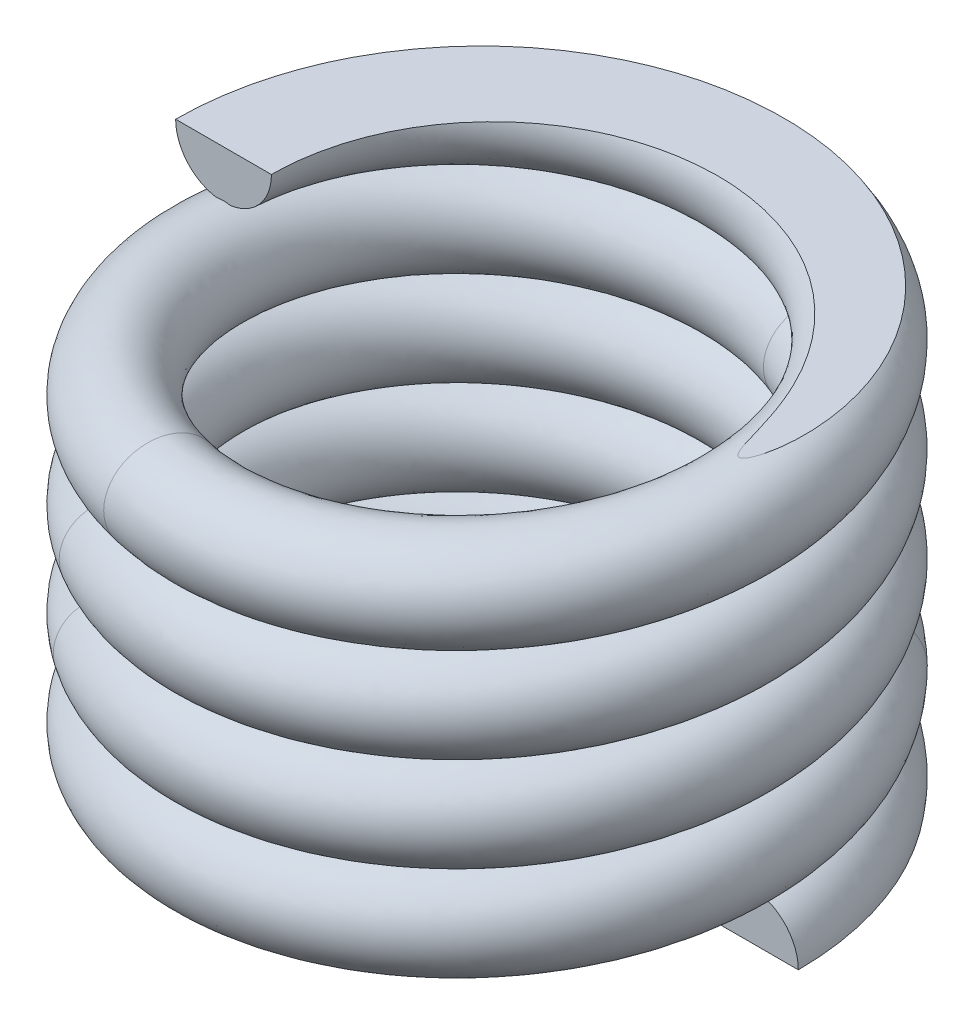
SolidWorks part; units mm, degrees
ref_plane "Спереди" through (0, 0, 0) normal (0, 0, 1) x (1, 0, 0)
ref_plane "Сверху" through (0, 0, 0) normal (0, 1, 0) x (1, 0, 0)
ref_plane "Справа" through (0, 0, 0) normal (1, 0, 0) x (0, 0, -1)
other "len"
sketch "Эскиз5" plane through (0, 0, 0) normal (0, 0, 1) x (1, 0, 0)
  circle A0 centre (6.985, 0) radius 1.27
  dimension "D2" = 2.54
  dimension "D1" = 6.985
sketch "Эскиз6" plane through (0, 0, 0) normal (0, 0, 1) x (1, 0, 0)
  line L0 (0, 0) -> (0, 11.2776)
  dimension "D1" = 11.2776
sweep "По траектории1" add profiles "Эскиз5" path "Эскиз6" parameters "D1"=1620
sketch "Эскиз7" plane through (0, 0, 0) normal (0, 0, 1) x (1, 0, 0)
  line L1 (8.89, 0) -> (-8.89, 0)
  line L2 (8.89, 0) -> (8.89, -1.397)
  line L3 (8.89, -1.397) -> (-8.89, -1.397)
  line L4 (-8.89, 0) -> (-8.89, -1.397)
  line L5 (8.89, 11.2776) -> (-8.89, 11.2776)
  line L6 (8.89, 11.2776) -> (8.89, 12.6746)
  line L7 (8.89, 12.6746) -> (-8.89, 12.6746)
  line L8 (-8.89, 11.2776) -> (-8.89, 12.6746)
  dimension "D1" = 17.78
  dimension "D2" = 1.397
extrude "Вырез-Вытянуть1" cut sketch "Эскиз7" against normal mid plane 25.4
